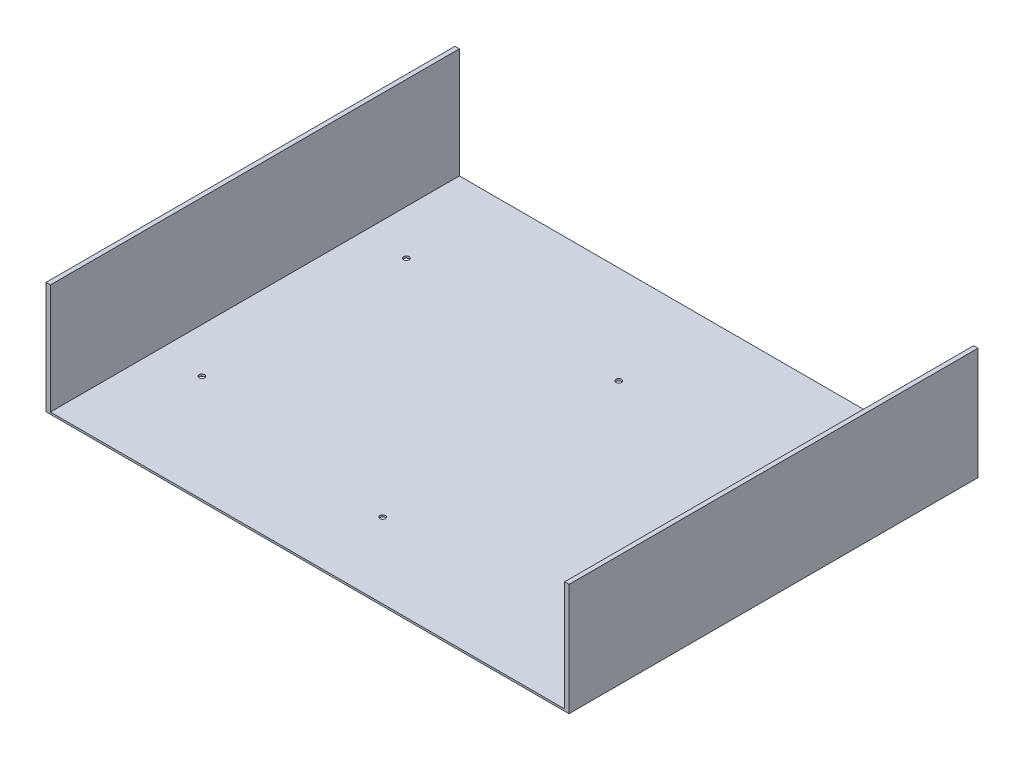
SolidWorks part; units mm, degrees
ref_plane "Front Plane" through (0, 0, 0) normal (0, 0, 1) x (1, 0, 0)
ref_plane "Top Plane" through (0, 0, 0) normal (0, 1, 0) x (1, 0, 0)
ref_plane "Right Plane" through (0, 0, 0) normal (1, 0, 0) x (0, 0, -1)
sketch "Sketch1" plane through (0, 0, 0) normal (0, 1, 0) x (1, 0, 0)
  line L1 (0, 0) -> (422.275, 0)
  line L2 (0, 0) -> (0, 330.2)
  line L3 (0, 330.2) -> (422.275, 330.2)
  line L4 (422.275, 0) -> (422.275, 330.2)
  dimension "D1" = 422.275
  dimension "D2" = 330.2
extrude "Boss-Extrude1" add sketch "Sketch1" along normal blind 1.5875
sketch "Sketch2" plane through (0, 1.5875, 0) normal (0, 1, 0) x (1, 0, 0)
  line L0 (0, 0) -> (422.275, 0) construction
  line L1 (0, 330.2) -> (3.556, 330.2)
  line L2 (0, 330.2) -> (0, 0)
  line L3 (0, 0) -> (3.556, 0)
  line L4 (3.556, 330.2) -> (3.556, 0)
  line L6 (422.275, 330.2) -> (418.719, 330.2)
  line L7 (422.275, 330.2) -> (422.275, 0)
  line L8 (422.275, 0) -> (418.719, 0)
  line L9 (418.719, 330.2) -> (418.719, 0)
  dimension "D1" = 3.556
  dimension "D2" = 3.556
extrude "Boss-Extrude2" add sketch "Sketch2" along normal blind 88.9
hole_wizard "#8 Clearance Hole1" positions "Sketch3" profile "Sketch4" hole size "#8" standard "ANSI Inch"
sketch "Sketch3" plane through (0, 1.5875, 0) normal (0, 1, 0) x (1, 0, 0)
  point P0 (39.6875, 251.2822)
  point P6 (211.1375, 251.2822)
  point P9 (382.5875, 251.2822)
  point P12 (382.5875, 60.7822)
  point P15 (211.1375, 60.7822)
  point P18 (39.6875, 86.1822)
sketch "Sketch4" plane through (39.6875, 1.5875, -251.2822) normal (1, 0, 0) x (0, 0, 1)
  line L0 (0, 0) -> (0, 1.5875)
  line L1 (0, 1.5875) -> (2.2479, 1.5875)
  line L2 (2.2479, 1.5875) -> (2.2479, 0)
  line L5 (2.2479, 0) -> (0, 0)
  line L11 (0, -6.35) -> (0, 107.95) construction
  dimension "Thru Hole Dia." = 4.4958
  dimension "Thru Hole Depth" = 1.5875
